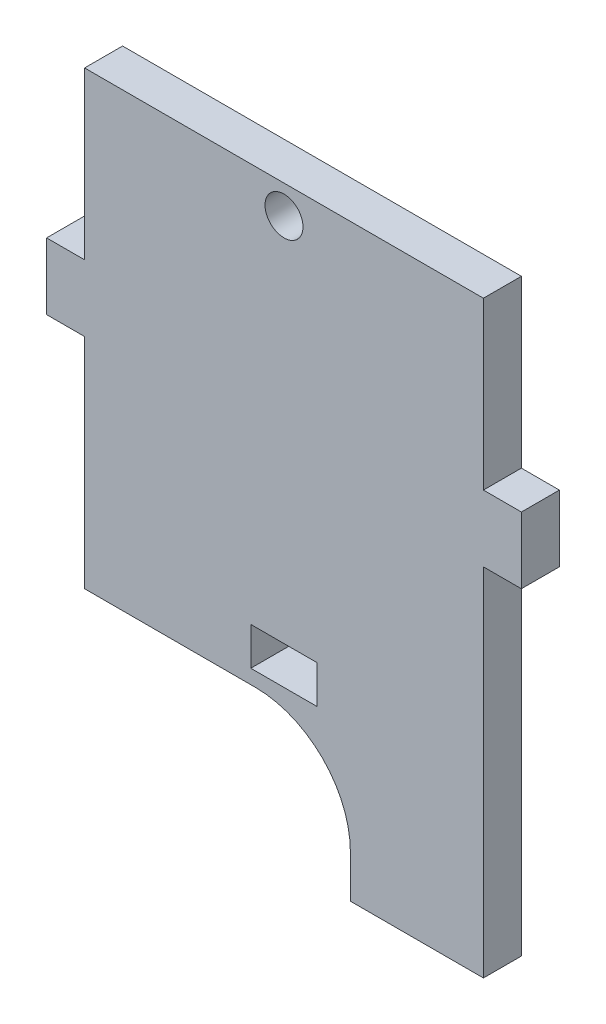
SolidWorks part; units mm, degrees
ref_plane "Front Plane" through (0, 0, 0) normal (0, 0, 1) x (1, 0, 0)
ref_plane "Top Plane" through (0, 0, 0) normal (0, 1, 0) x (1, 0, 0)
ref_plane "Right Plane" through (0, 0, 0) normal (1, 0, 0) x (0, 0, -1)
sketch "Sketch1" plane through (0, 0, 0) normal (0, 0, 1) x (1, 0, 0)
  line L0 (22.4511, -10.8647) -> (26.4511, -10.8647)
  line L1 (-19.5489, 6.6353) -> (22.4511, 6.6353)
  line L2 (-19.5489, 6.6353) -> (-19.5489, -55.3647)
  line L3 (-19.5489, -55.3647) -> (-2.0489, -55.3647)
  line L4 (22.4511, 6.6353) -> (22.4511, -55.3647)
  line L5 (-19.5489, 6.6353) -> (22.4511, -55.3647) construction
  line L6 (-19.5489, -55.3647) -> (22.4511, 6.6353) construction
  line L8 (-2.0489, -55.3647) -> (-2.0489, -55.3876)
  line L9 (-2.0489, -55.3876) -> (4.9511, -55.3876)
  line L10 (4.9511, -55.3647) -> (4.9511, -55.3876)
  line L11 (-27.8841, -40.8647) -> (8.4411, -40.8647)
  line L12 (-27.8841, -40.8647) -> (-27.8841, -55.3647)
  line L13 (-2.0489, -35.3647) -> (4.9511, -35.3647)
  line L14 (-2.0489, -35.3647) -> (-2.0489, -39.3647)
  line L15 (-2.0489, -39.3647) -> (4.9511, -39.3647)
  line L16 (4.9511, -35.3647) -> (4.9511, -39.3647)
  line L17 (-27.8841, -55.3647) -> (8.4411, -55.3647)
  line L18 (8.4411, -40.8647) -> (8.4411, -55.3647)
  line L19 (-23.5489, -10.8647) -> (-19.5489, -10.8647)
  line L20 (-23.5489, -10.8647) -> (-23.5489, -17.8647)
  line L21 (-23.5489, -17.8647) -> (-19.5489, -17.8647)
  line L22 (-19.5489, -10.8647) -> (-19.5489, -17.8647)
  line L25 (22.4511, -10.8647) -> (22.4511, -17.8647)
  line L26 (22.4511, -17.8647) -> (26.4511, -17.8647)
  line L27 (26.4511, -10.8647) -> (26.4511, -17.8647)
  line L30 (4.9511, -55.3647) -> (22.4511, -55.3647)
  circle A0 centre (1.4511, 3.6353) radius 2
  point P0 (1.4511, -24.3647)
  point P5 (1.4511, -59.3647)
  point P10 (1.4511, -55.3876)
  point P11 (1.4511, 6.6353)
  point P12 (-4.0489, -37.3647)
  point P19 (-27.0489, -14.3457)
  point P26 (18.9511, -14.3457)
  point P31 (-23.5489, -14.3647)
  point P32 (1.4511, -35.3647)
  dimension "D3" = 3
  dimension "D1" = 42
  dimension "D2" = 62
  dimension "D4" = 17.5
  dimension "D5" = 50
  dimension "D6" = 18.01
extrude "Boss-Extrude1" add sketch "Sketch1" along normal blind 4 contours L10 L30 L4 L1 L2 L3 L8 L9 A0 L13 L16 L15 L14 | L20 L21 L22 L19 | L27 L26 L25 L0
fillet "Fillet5" radius 10 1 edges at (8.4411, -40.8647, 2)
